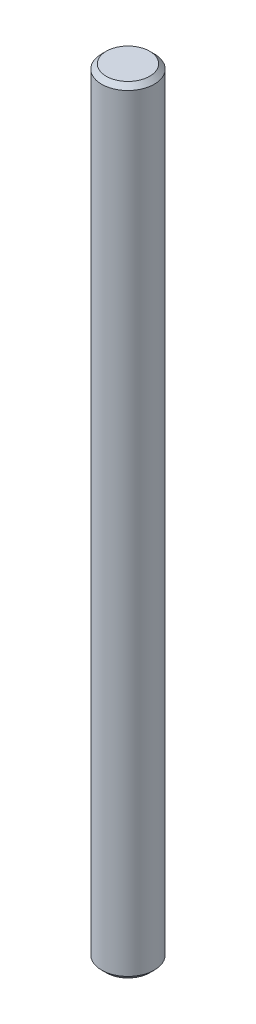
SolidWorks part; units mm, degrees
ref_plane "Front Plane" through (0, 0, 0) normal (0, 0, 1) x (1, 0, 0)
ref_plane "Top Plane" through (0, 0, 0) normal (0, 1, 0) x (1, 0, 0)
ref_plane "Right Plane" through (0, 0, 0) normal (1, 0, 0) x (0, 0, -1)
sketch "Sketch1" plane through (0, 0, 0) normal (0, 1, 0) x (1, 0, 0)
  circle A0 centre (0, 0) radius 2
  dimension "D1" = 4
extrude "Extrude1" add sketch "Sketch1" along normal blind 59
chamfer "Chamfer2" distance 0.35 angle 45 2 edges at (0, 0, 2) (0, 59, 2)
